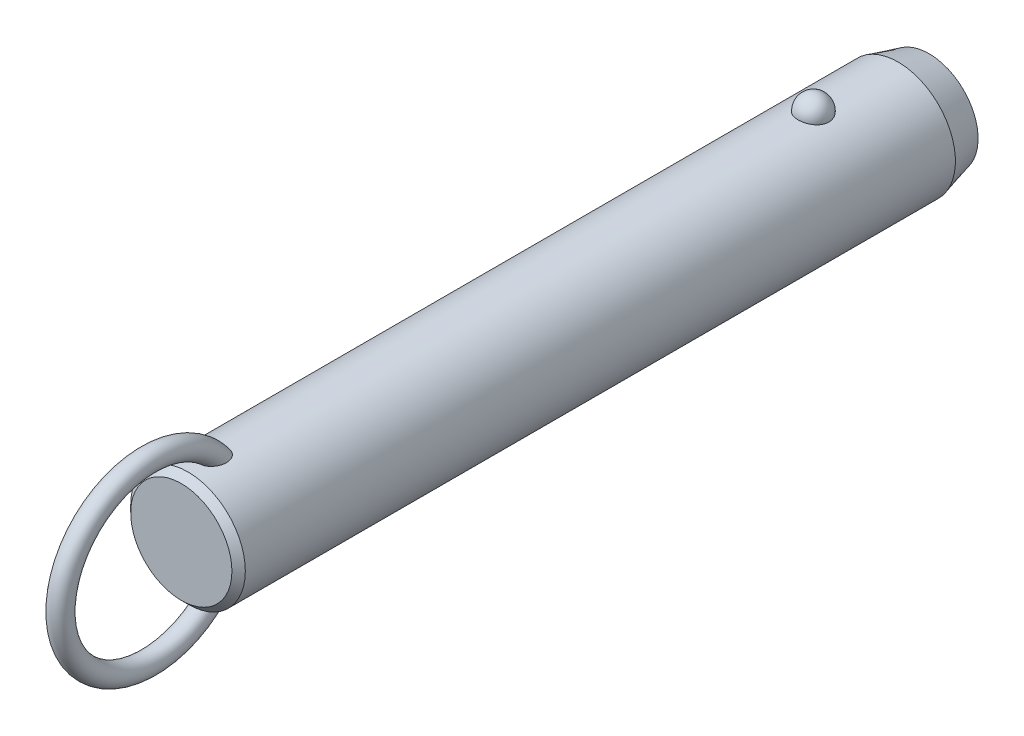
SolidWorks part; units mm, degrees
ref_plane "Front Plane" through (0, 0, 0) normal (0, 0, 1) x (1, 0, 0)
ref_plane "Top Plane" through (0, 0, 0) normal (0, 1, 0) x (1, 0, 0)
ref_plane "Right Plane" through (0, 0, 0) normal (1, 0, 0) x (0, 0, -1)
sketch "Sketch2" plane through (0, 0, 0) normal (0, 0, 1) x (1, 0, 0)
  circle A0 centre (0, 0) radius 11.1
  point P3 (0, 11.1)
  dimension "D1" = 22.2
extrude "Boss-Extrude1" add sketch "Sketch2" along normal blind 106.7
sketch "Sketch3" plane through (0, 0, 0) normal (0, 0, -1) x (-1, 0, 0)
  circle A0 centre (0, 0) radius 11.1
  dimension "D1" = 22.2
extrude "Boss-Extrude2" add sketch "Sketch3" along normal blind 25.4
chamfer "Chamfer1" distance 6 angle 15 1 edges at (-11.1, 0, -25.4)
sketch "Sketch12" plane through (0, 0, 0) normal (1, 0, 0) x (0, 0, -1)
  line L0 (-106.7, 11.1) -> (-106.7, -11.1) construction
  point P0 (-106.7, 0)
sketch "Sketch13" plane through (0, 0, 0) normal (1, 0, 0) x (0, 0, -1)
  circle A0 centre (-125.75, 0) radius 19.05
  point P2 (-106.7, 0)
  dimension "D1" = 38.1
sketch "Sketch14" plane through (0, 0, 0) normal (0, 1, 0) x (1, 0, 0)
  circle A0 centre (0, -108.7) radius 2
  point P2 (0, -106.7)
  dimension "D1" = 4
sweep "Sweep1" add profiles "Sketch14" path "Sketch13"
sketch "Sketch15" plane through (0, 0, 106.7) normal (0, 0, 1) x (1, 0, 0)
  circle A0 centre (0, 0) radius 11.1
  dimension "D1" = 22.2
extrude "Boss-Extrude3" add sketch "Sketch15" along normal blind 12.7
chamfer "Chamfer2" distance 1.3 angle 45 1 edges at (11.1, 0, 119.4)
sketch "Sketch18" plane through (0, 0, 0) normal (1, 0, 0) x (0, 0, -1)
  line L0 (19.4, 11.1) -> (-110.268, 11.1) construction
  line L1 (3, 14.1) -> (3, 8.1)
  line L2 (-110.268, -11.1) -> (19.4, -11.1) construction
  arc A0 (3, 14.1) -> (3, 8.1) centre (3, 11.1) ccw
  point P4 (0, 11.1)
  dimension "D1" = 25.2
revolve "Revolve1" add sketch "Sketch18" angle 360 about L1
